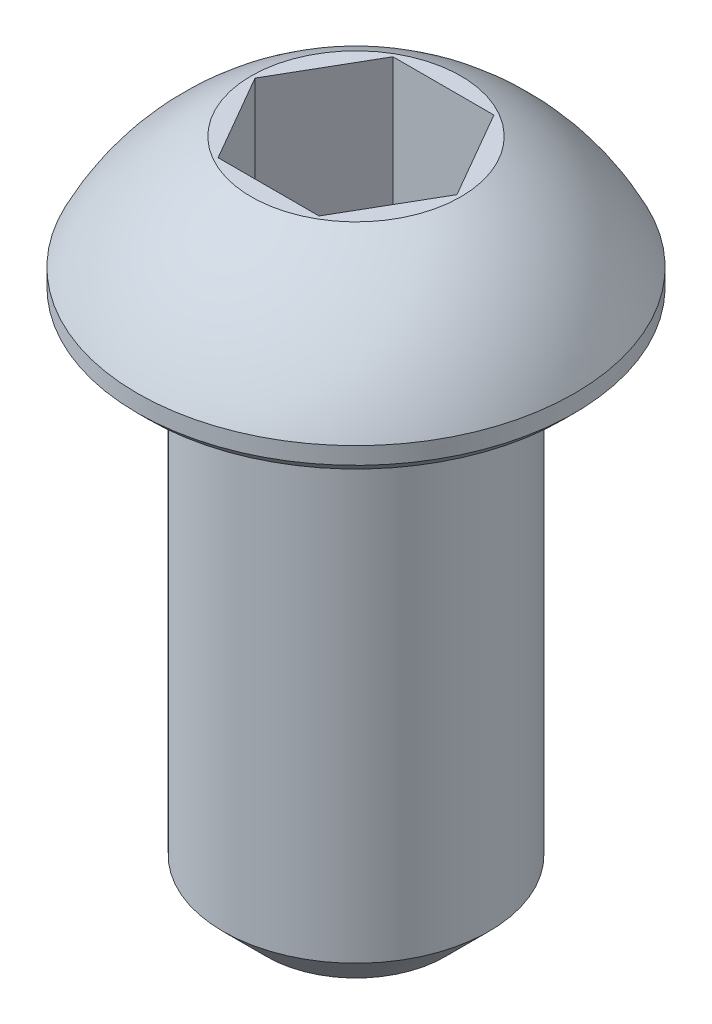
SolidWorks part; units mm, degrees
ref_plane "Front Plane" through (0, 0, 0) normal (0, 0, 1) x (1, 0, 0)
ref_plane "Top Plane" through (0, 0, 0) normal (0, 1, 0) x (1, 0, 0)
ref_plane "Right Plane" through (0, 0, 0) normal (1, 0, 0) x (0, 0, -1)
sketch "Sketch1" plane through (0, 0, 0) normal (0, 0, 1) x (1, 0, 0)
  line L0 (0, 0) -> (0, -50000) construction
  line L1 (0, 0.508) -> (3.9688, 0.508) construction
  line L2 (3.9688, 0.508) -> (3.9687, 0)
  line L3 (3.9687, 0) -> (2.413, 0)
  line L4 (2.413, 0) -> (2.413, -9.525)
  line L5 (2.413, -9.525) -> (0, -9.525)
  line L6 (0, -9.525) -> (0, 2.5654)
  line L9 (1.9028, 2.5654) -> (0, 2.5654)
  arc A0 (3.9688, 0.508) -> (1.9028, 2.5654) centre (0, -1.4113) ccw
  dimension "D6" = 4.4085
  dimension "D1" = 0.508
  dimension "D2" = 7.9375
  dimension "D3" = 4.826
  dimension "D4" = 9.525
  dimension "D5" = 2.5654
revolve "Revolve1" add sketch "Sketch1" angle 360 about L0
sketch "Sketch2" plane through (0, 2.5654, 0) normal (0, 1, 0) x (1, 0, 0)
  line L0 (0, 0) -> (0, 50000) construction
  line L1 (0, 0) -> (50000, 0) construction
  line L2 (-0.9165, 1.5875) -> (0.9165, 1.5875)
  line L3 (0.9165, 1.5875) -> (1.8331, 0)
  line L4 (-0.9165, 1.5875) -> (-1.8331, 0)
  line L5 (-1.8331, 0) -> (-0.9165, -1.5875)
  line L6 (-0.9165, -1.5875) -> (0.9165, -1.5875)
  line L7 (0.9165, -1.5875) -> (1.8331, 0)
  dimension "D1" = 30
  dimension "D2" = 3.175
extrude "Cut-Extrude1" cut sketch "Sketch2" against normal blind 2.3813
chamfer "Chamfer1" distance 0.1984 angle 45 1 edges at (0, 0, 3.9687)
chamfer "Chamfer2" distance 0.7937 angle 45 1 edges at (0, -9.525, 2.413)
